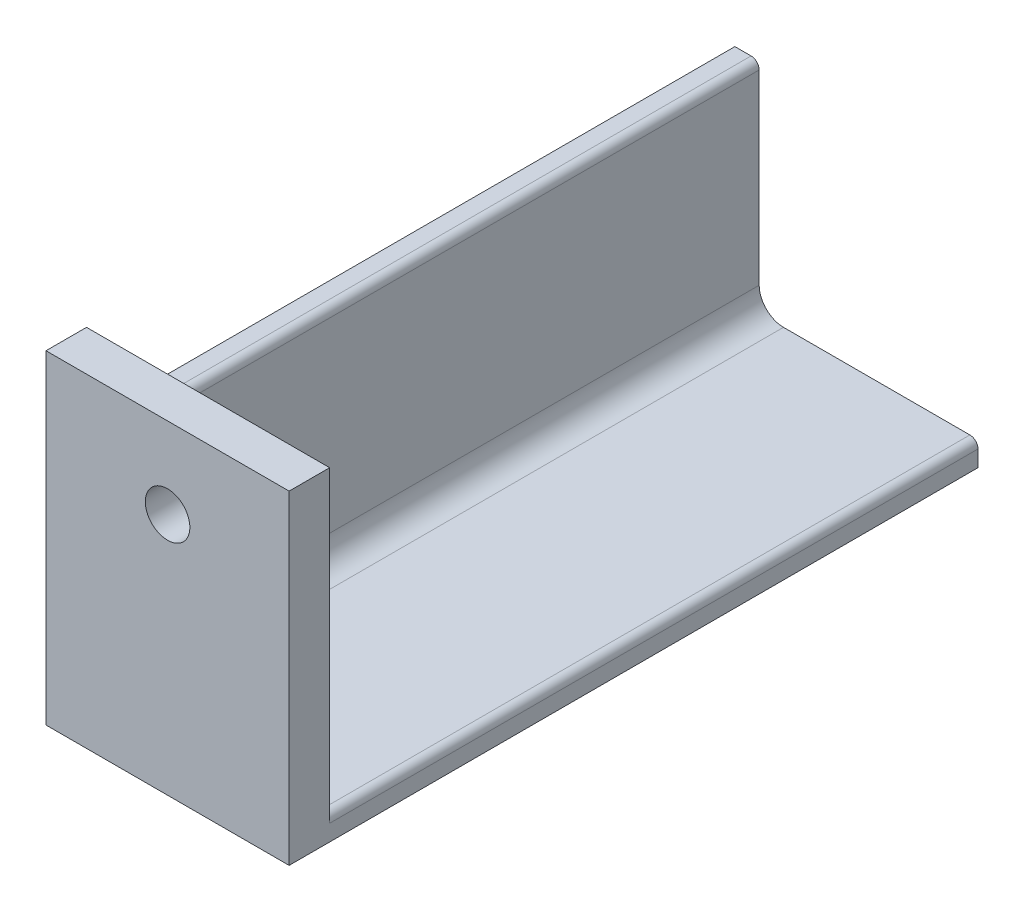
SolidWorks part; units mm, degrees
ref_plane "Front Plane" through (0, 0, 0) normal (0, 0, 1) x (1, 0, 0)
ref_plane "Top Plane" through (0, 0, 0) normal (0, 1, 0) x (1, 0, 0)
ref_plane "Right Plane" through (0, 0, 0) normal (1, 0, 0) x (0, 0, -1)
sketch "Sketch1" plane through (0, 0, 0) normal (0, 0, 1) x (1, 0, 0)
  line L0 (0, 60) -> (0, 0)
  line L1 (0, 0) -> (60, 0)
  line L2 (60, 0) -> (60, 4)
  line L3 (58, 6) -> (12, 6)
  line L4 (6, 12) -> (6, 58)
  line L5 (4, 60) -> (0, 60)
  arc A0 (12, 6) -> (6, 12) centre (12, 12) cw
  arc A1 (6, 58) -> (4, 60) centre (4, 58) ccw
  arc A2 (60, 4) -> (58, 6) centre (58, 4) ccw
  point P11 (6, 60)
  dimension "D3" = 6
  dimension "D4" = 2
  dimension "D1" = 60
  dimension "D2" = 6
extrude "Boss-Extrude1" add sketch "Sketch1" along normal blind 160
sketch "Sketch2" plane through (0, 0, 160) normal (0, 0, 1) x (1, 0, 0)
  line L0 (60, 0) -> (60, 4) construction
  line L1 (0, 0) -> (60, 0)
  line L2 (0, 0) -> (0, 80)
  line L3 (0, 80) -> (60, 80)
  line L4 (60, 0) -> (60, 80)
  dimension "D1" = 80
extrude "Boss-Extrude2" add sketch "Sketch2" along normal blind 10
sketch "Sketch3" plane through (0, 0, 160) normal (0, 0, -1) x (-1, 0, 0)
  line L0 (-30, 60) -> (-30, 80) construction
  line L1 (-60, 80) -> (0, 80) construction
  circle A0 centre (-30, 60) radius 5.5
  dimension "D1" = 11
  dimension "D2" = 20
extrude "Cut-Extrude1" cut sketch "Sketch3" against normal blind 10
